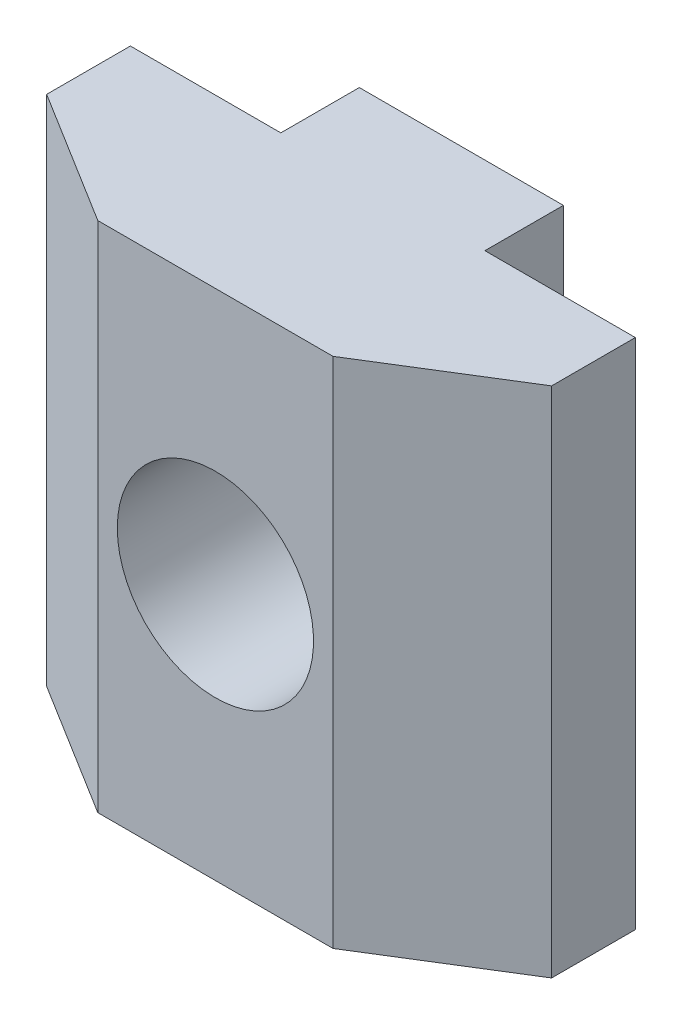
SolidWorks part; units mm, degrees
ref_plane "前视基准面" through (0, 0, 0) normal (0, 0, 1) x (1, 0, 0)
ref_plane "上视基准面" through (0, 0, 0) normal (0, 1, 0) x (1, 0, 0)
ref_plane "右视基准面" through (0, 0, 0) normal (1, 0, 0) x (0, 0, -1)
other "Configuration Table"
sketch "草图1" plane through (0, 0, 0) normal (0, 1, 0) x (1, 0, 0)
  line L10 (-4.495, 0) -> (4.495, 0)
  line L11 (4.495, 0) -> (9.65, 3.2)
  line L12 (9.65, 3.2) -> (9.65, 6.4)
  line L13 (9.65, 6.4) -> (3.9, 6.4)
  line L14 (3.9, 6.4) -> (3.9, 9.4)
  line L15 (3.9, 9.4) -> (-3.9, 9.4)
  line L16 (-3.9, 9.4) -> (-3.9, 6.4)
  line L17 (-3.9, 6.4) -> (-9.65, 6.4)
  line L18 (-9.65, 6.4) -> (-9.65, 3.2)
  line L19 (-9.65, 3.2) -> (-4.495, 0)
  point P11 (0, 0)
  point P13 (0, 9.4)
  dimension "D1" = 19.3
  dimension "D2" = 7.8
  dimension "D3" = 9.4
  dimension "D4" = 6.4
  dimension "D5" = 6.4
  dimension "D6" = 5.75
  dimension "D7" = 3.2
  dimension "D8" = 3.2
  dimension "D9" = 8.99
extrude "凸台-拉伸1" add sketch "草图1" along normal blind 19.6
sketch "草图2" plane through (0, 0, -9.4) normal (0, 0, -1) x (-1, 0, 0)
  line L0 (9.65, 9.8) -> (-9.65, 9.8) construction
  line L1 (9.65, 19.6) -> (9.65, 0) construction
  line L2 (-9.65, 19.6) -> (-9.65, 0) construction
  line L3 (0, 19.6) -> (0, 0) construction
  line L4 (-3.9, 19.6) -> (3.9, 19.6) construction
  circle A0 centre (0, 9.8) radius 3.75
  dimension "D1" = 7.5
extrude "切除-拉伸1" cut sketch "草图2" against normal through all
